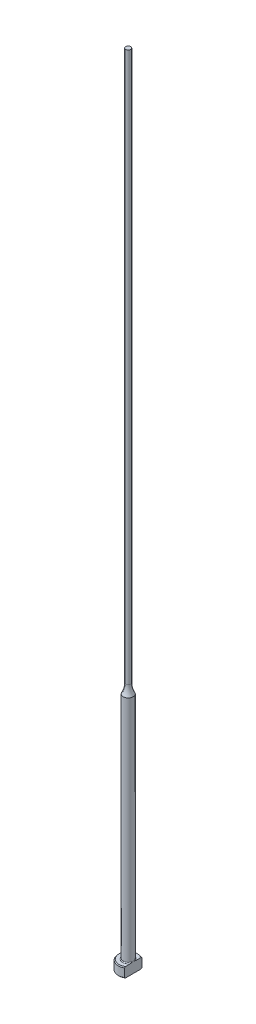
SolidWorks part; units mm, degrees
ref_plane "Front Plane" through (0, 0, 0) normal (0, 0, 1) x (1, 0, 0)
ref_plane "Top Plane" through (0, 0, 0) normal (0, 1, 0) x (1, 0, 0)
ref_plane "Right Plane" through (0, 0, 0) normal (1, 0, 0) x (0, 0, -1)
sketch "Sketch1" plane through (0, 0, 0) normal (0, 0, 1) x (1, 0, 0)
  line L0 (0, 259.9588) -> (0, -15.1925) construction
  line L1 (0, 0) -> (-3.175, 0)
  line L2 (-3.175, 0) -> (-3.175, 3.175)
  line L3 (-3.175, 3.175) -> (-1.5875, 3.175)
  line L4 (-0.7937, 79.2742) -> (-0.7937, 254)
  line L5 (-0.7937, 254) -> (0, 254)
  line L6 (0, 254) -> (0, 0)
  line L7 (-1.5875, 3.175) -> (-1.5875, 76.2)
  arc A0 (-1.5875, 76.2) -> (-0.7937, 79.2742) centre (-7.1437, 79.2742) ccw
  point P13 (-1.5875, 0)
  dimension "D1" = 6.35
  dimension "L" = 254
  dimension "D2" = 3.175
  dimension "H" = 6.35
  dimension "T" = 3.175
  dimension "D" = 1.5875
  dimension "S" = 76.2
revolve "Revolve1" add sketch "Sketch1" angle 360 about L0
chamfer "Chamfer1" distance 0.254 angle 45 2 edges at (0, 3.175, 3.175) (0, 0, 3.175)
fillet "Fillet1" radius 0.254 1 edges at (0, 3.175, 1.5875)
sketch "Sketch2" plane through (0, 0, 0) normal (0, 1, 0) x (1, 0, 0)
  line L0 (1.5875, -2.7496) -> (1.5875, 2.7496)
  circle A0 centre (0, 0) radius 3.175 construction
  arc A2 (1.5875, -2.7496) -> (1.5875, 2.7496) centre (0, 0) ccw
  circle A3 centre (0, 0) radius 3.175 construction
  circle A4 centre (0, 0) radius 1.5875 construction
extrude "Key Head" cut sketch "Sketch2" along normal up to next
